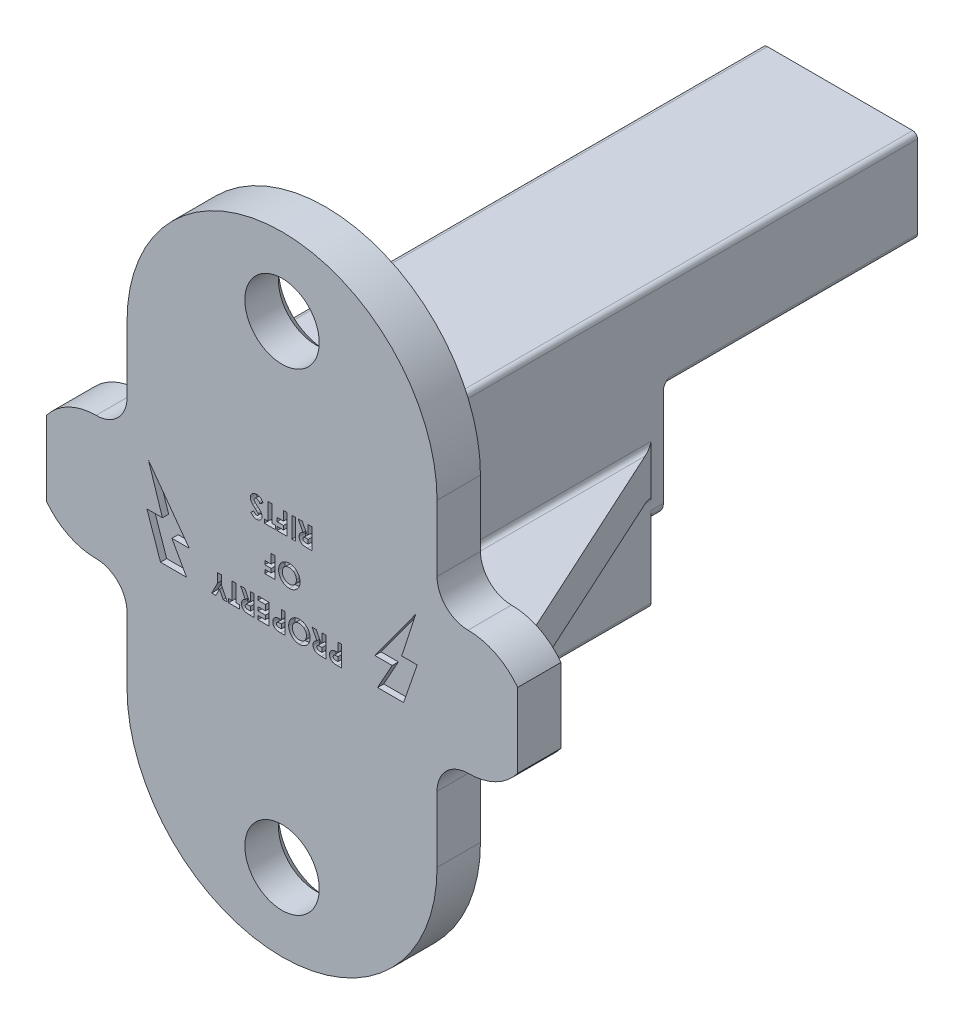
SolidWorks part; units mm, degrees
ref_plane "Front Plane" through (0, 0, 0) normal (0, 0, 1) x (1, 0, 0)
ref_plane "Top Plane" through (0, 0, 0) normal (0, 1, 0) x (1, 0, 0)
ref_plane "Right Plane" through (0, 0, 0) normal (1, 0, 0) x (0, 0, -1)
sketch "Sketch1" plane through (0, 0, 0) normal (0, 0, 1) x (1, 0, 0)
  line L1 (-683.5225, -1291.2464) -> (-651.7725, -1291.2464)
  line L2 (-683.5225, -1291.2464) -> (-683.5225, -1234.1695)
  line L3 (-683.5225, -1291.2464) -> (-651.7725, -1291.2464)
  line L4 (-683.5225, -1234.1695) -> (-651.7725, -1234.1695)
  line L5 (-651.7725, -1291.2464) -> (-651.7725, -1234.1695)
  line L6 (-658.1225, -1276.0275) -> (-677.1725, -1276.0275)
  line L7 (-683.5225, -1282.3775) -> (-683.5225, -1291.2464)
  line L8 (-651.7725, -1291.2464) -> (-651.7725, -1282.3775)
  circle A2 centre (-667.6475, -1337.5375) radius 25
  circle A4 centre (-705.1475, -1337.5375) radius 2.75
  circle A6 centre (-686.3975, -1370.0135) radius 2.75
  circle A8 centre (-648.8975, -1370.0135) radius 2.75
  circle A10 centre (-648.8975, -1305.0616) radius 2.75
  circle A12 centre (-630.1475, -1337.5375) radius 2.75
  circle A14 centre (-686.3975, -1305.0616) radius 2.75
  circle A16 centre (-659.9185, -1285.0159) radius 2.9
  circle A18 centre (-675.3764, -1285.0159) radius 2.9
  arc A28 (-677.1725, -1276.0275) -> (-683.5225, -1282.3775) centre (-677.1725, -1282.3775) ccw
  arc A29 (-687.1241, -1296.9708) -> (-683.5225, -1291.2464) centre (-689.8725, -1291.2464) ccw
  arc A30 (-687.1241, -1296.9708) -> (-648.1709, -1296.9708) centre (-667.6475, -1337.5375) ccw
  arc A31 (-651.7725, -1291.2464) -> (-648.1709, -1296.9708) centre (-645.4225, -1291.2464) ccw
  arc A32 (-651.7725, -1282.3775) -> (-658.1225, -1276.0275) centre (-658.1225, -1282.3775) ccw
extrude "Boss-Extrude1" add sketch "Sketch1" along normal blind 12.7 contours A32 L5 L4 L2 A28 L6 | L5 A32 L6 A28 L2 L1 A18 A16
sketch "Sketch2" plane through (0, 0, 12.7) normal (0, 0, 1) x (1, 0, 0)
  line L0 (-651.7725, -1272.2695) -> (-683.5225, -1272.2695)
  line L4 (-683.5225, -1234.1695) -> (-683.5225, -1291.2464)
  line L5 (-683.5225, -1291.2464) -> (-651.7725, -1291.2464)
  line L6 (-651.7725, -1291.2464) -> (-651.7725, -1234.1695)
  line L7 (-651.7725, -1234.1695) -> (-683.5225, -1234.1695)
  line L8 (-683.5225, -1234.1695) -> (-683.5225, -1291.2464)
  line L9 (-683.5225, -1291.2464) -> (-651.7725, -1291.2464)
  line L10 (-651.7725, -1291.2464) -> (-651.7725, -1234.1695)
  line L11 (-651.7725, -1234.1695) -> (-683.5225, -1234.1695)
  circle A0 centre (-675.3764, -1285.0159) radius 2.9 construction
  circle A1 centre (-659.9185, -1285.0159) radius 2.9 construction
  circle A2 centre (-675.3764, -1285.0159) radius 2.9
  circle A3 centre (-659.9185, -1285.0159) radius 2.9
  dimension "D2" = 38.1
  dimension "D1" = 0
extrude "Boss-Extrude2" add sketch "Sketch2" along normal blind 101.6 contours L0 M8 M9 M6
ref_plane "Plane1" through (-667.6475, 0, 0) normal (1, 0, 0) x (0, 0, -1)
sketch "Sketch7" plane through (0, -1272.2695, 0) normal (0, -1, 0) x (1, 0, 0)
  line L1 (-642.6475, 54.61) -> (-692.6475, 54.61)
  line L4 (-683.5225, 12.7) -> (-651.7725, 12.7)
  line L5 (-651.7725, 12.7) -> (-651.7725, 114.3)
  line L6 (-651.7725, 114.3) -> (-683.5225, 114.3)
  line L7 (-683.5225, 114.3) -> (-683.5225, 12.7)
  line L8 (-683.5225, 12.7) -> (-651.7725, 12.7)
  line L9 (-651.7725, 12.7) -> (-651.7725, 114.3)
  line L10 (-651.7725, 114.3) -> (-683.5225, 114.3)
  line L11 (-683.5225, 114.3) -> (-683.5225, 12.7)
  dimension "D1" = 0
extrude "Boss-Extrude4" add sketch "Sketch7" along normal blind 57.15 contours L1 M6 M7 M8
sketch "Sketch8" plane through (0, 0, 114.3) normal (0, 0, 1) x (1, 0, 0)
  line L4 (-683.5225, -1234.1695) -> (-683.5225, -1329.4195)
  line L5 (-683.5225, -1329.4195) -> (-651.7725, -1329.4195)
  line L6 (-651.7725, -1329.4195) -> (-651.7725, -1234.1695)
  line L7 (-651.7725, -1234.1695) -> (-683.5225, -1234.1695)
  line L8 (-683.5225, -1234.1695) -> (-683.5225, -1329.4195)
  line L9 (-683.5225, -1329.4195) -> (-651.7725, -1329.4195)
  line L10 (-651.7725, -1329.4195) -> (-651.7725, -1234.1695)
  line L11 (-651.7725, -1234.1695) -> (-683.5225, -1234.1695)
  circle A1 centre (-667.6475, -1337.5375) radius 12.3
  circle A2 centre (-667.6475, -1337.5375) radius 25 construction
  dimension "D1" = 0
  dimension "D2" = 12.7
extrude "Cut-Extrude4" cut sketch "Sketch8" against normal through all contours L9 A1
ref_plane "Plane3" through (-667.6475, 0, 0) normal (1, 0, 0) x (0, 0, -1)
sketch "Sketch11" plane through (-667.6475, 0, 0) normal (1, 0, 0) x (0, 0, -1)
  line L0 (-54.61, -1272.2695) -> (-12.7, -1272.2695) construction
  line L1 (-114.3, -1329.4195) -> (-114.3, -1234.1695) construction
  line L2 (0, -1291.2464) -> (0, -1234.1695) construction
  line L3 (-54.61, -1272.2695) -> (-12.7, -1272.2695) construction
  line L4 (-114.3, -1329.4195) -> (-114.3, -1234.1695) construction
  line L5 (0, -1291.2464) -> (0, -1234.1695) construction
  line L6 (-54.61, -1272.2695) -> (-114.3, -1272.2695) construction
  line L7 (0, -1243.1425) -> (-114.3, -1263.2966)
  line L8 (-114.3, -1234.1695) -> (0, -1234.1695) construction
  line L9 (0, -1234.1695) -> (0, -1243.1425) construction
  line L10 (-114.3, -1263.2966) -> (-114.3, -1272.2695) construction
  point P6 (0, -1243.1425)
  dimension "D1" = 10
ref_plane "Plane4" through (-667.6475, -1243.1425, 0) normal (0, -0.1736, 0.9848) x (1, 0, 0)
sketch "Sketch13" plane through (-667.6475, -1243.1425, 0) normal (0, -0.1736, 0.9848) x (1, 0, 0)
  line L8 (28.575, 21.5366) -> (-28.575, 21.5366)
  line L9 (28.575, -60.0731) -> (28.575, 21.5366)
  line L10 (-28.575, -60.0731) -> (28.575, -60.0731)
  line L11 (-28.575, 21.5366) -> (-28.575, -60.0731)
  line L12 (28.575, 21.5366) -> (-28.575, 21.5366)
  line L13 (28.575, -60.0731) -> (28.575, 21.5366)
  line L14 (-28.575, -60.0731) -> (28.575, -60.0731)
  line L15 (-28.575, 21.5366) -> (-28.575, -60.0731)
  dimension "D1" = 12.7
sketch "Sketch16" plane through (0, 0, 54.61) normal (0, 0, -1) x (-1, 0, 0)
  line L5 (676.8881, -1329.4195) -> (683.5225, -1329.4195)
  line L6 (683.5225, -1329.4195) -> (683.5225, -1272.2695)
  line L7 (683.5225, -1272.2695) -> (651.7725, -1272.2695)
  line L8 (651.7725, -1272.2695) -> (651.7725, -1329.4195)
  line L9 (651.7725, -1329.4195) -> (658.4069, -1329.4195)
  line L10 (676.8881, -1329.4195) -> (683.5225, -1329.4195)
  line L11 (683.5225, -1329.4195) -> (683.5225, -1272.2695)
  line L12 (683.5225, -1272.2695) -> (651.7725, -1272.2695)
  line L13 (651.7725, -1272.2695) -> (651.7725, -1329.4195)
  line L14 (651.7725, -1329.4195) -> (658.4069, -1329.4195)
  arc A1 (676.8881, -1329.4195) -> (658.4069, -1329.4195) centre (667.6475, -1337.5375) ccw
  arc A2 (676.8881, -1329.4195) -> (658.4069, -1329.4195) centre (667.6475, -1337.5375) ccw
  circle A3 centre (667.6475, -1337.5375) radius 25 construction
  circle A4 centre (667.6475, -1337.5375) radius 26.27
  dimension "D1" = 0
  dimension "D2" = 1.27
extrude "Boss-Extrude6" add sketch "Sketch16" along normal blind 2.54 contours A4 L11 M10 M11
fillet "Fillet8" radius 2.54 2 edges at (-683.5225, -1316.6067, 53.34) (-651.7725, -1316.6067, 53.34)
sketch "Sketch19" plane through (0, 0, 114.3) normal (0, 0, 1) x (1, 0, 0)
  line L0 (-669.4127, -1270.1271) -> (-661.9715, -1270.1271)
  line L1 (-661.9715, -1270.1271) -> (-666.1374, -1277.5684)
  line L2 (-666.1374, -1277.5684) -> (-661.167, -1277.5684)
  line L3 (-661.167, -1277.5684) -> (-672.9466, -1293.8012)
  line L4 (-672.9466, -1293.8012) -> (-668.8668, -1281.4183)
  line L5 (-668.8668, -1281.4183) -> (-673.5499, -1281.4183)
  line L6 (-673.5499, -1281.4183) -> (-669.4127, -1270.1271)
  line L7 (-668.8668, -1281.4183) -> (-666.1374, -1277.5684) construction
sketch "Sketch20" plane through (0, 0, 12.7) normal (0, 0, 1) x (1, 0, 0)
  line L4 (-683.5225, -1272.2695) -> (-683.5225, -1291.2464)
  line L5 (-683.5225, -1291.2464) -> (-651.7725, -1291.2464)
  line L6 (-651.7725, -1291.2464) -> (-651.7725, -1272.2695)
  line L7 (-651.7725, -1272.2695) -> (-683.5225, -1272.2695)
  line L8 (-683.5225, -1272.2695) -> (-683.5225, -1291.2464)
  line L9 (-683.5225, -1291.2464) -> (-651.7725, -1291.2464)
  line L10 (-651.7725, -1291.2464) -> (-651.7725, -1272.2695)
  line L11 (-651.7725, -1272.2695) -> (-683.5225, -1272.2695)
  circle A0 centre (-659.9185, -1285.0159) radius 2.9 construction
  circle A1 centre (-675.3764, -1285.0159) radius 2.9 construction
  circle A6 centre (-659.9185, -1285.0159) radius 2.9
  circle A7 centre (-675.3764, -1285.0159) radius 2.9
  dimension "D1" = 0
extrude "Boss-Extrude7" add sketch "Sketch20" along normal up to surface (39.37 mm away)
sketch "Sketch21" plane through (0, 0, 0) normal (0, 0, -1) x (-1, 0, 0)
  line L0 (651.7725, -1253.2195) -> (683.5225, -1253.2195)
  line L4 (651.7725, -1291.2464) -> (683.5225, -1291.2464)
  line L5 (683.5225, -1291.2464) -> (683.5225, -1234.1695)
  line L6 (683.5225, -1234.1695) -> (651.7725, -1234.1695)
  line L7 (651.7725, -1234.1695) -> (651.7725, -1291.2464)
  line L8 (651.7725, -1291.2464) -> (683.5225, -1291.2464)
  line L9 (683.5225, -1291.2464) -> (683.5225, -1234.1695)
  line L10 (683.5225, -1234.1695) -> (651.7725, -1234.1695)
  line L11 (651.7725, -1234.1695) -> (651.7725, -1291.2464)
  dimension "D2" = 19.05
  dimension "D1" = 0
extrude "Cut-Extrude5" cut sketch "Sketch21" against normal through all contours L0 M12 M10 M11
sketch "Sketch22" plane through (-667.6475, 0, 0) normal (1, 0, 0) x (0, 0, -1)
  line L0 (-1.6908, -1262.8083) -> (-114.3, -1282.6643)
  line L10 (0, -1253.2195) -> (-114.3, -1253.2195)
  line L11 (-114.3, -1253.2195) -> (-114.3, -1329.4195)
  line L12 (-114.3, -1329.4195) -> (-54.61, -1329.4195)
  line L13 (-54.61, -1329.4195) -> (-54.61, -1311.9994)
  line L14 (-54.61, -1311.9994) -> (-52.07, -1311.9994)
  line L15 (-54.61, -1311.9994) -> (-52.07, -1311.9994)
  line L16 (-52.07, -1311.9994) -> (-52.07, -1291.2464)
  line L17 (0, -1291.2464) -> (0, -1253.2195)
  line L19 (0, -1253.2195) -> (-114.3, -1253.2195) construction
  line L20 (-114.3, -1253.2195) -> (-114.3, -1329.4195) construction
  line L21 (-114.3, -1329.4195) -> (-54.61, -1329.4195) construction
  line L22 (-54.61, -1329.4195) -> (-54.61, -1311.9994) construction
  line L26 (0, -1291.2464) -> (0, -1253.2195) construction
  line L28 (-52.07, -1311.9994) -> (-52.07, -1291.2464)
  line L29 (-52.07, -1291.2464) -> (0, -1291.2464)
  line L30 (-52.07, -1291.2464) -> (0, -1291.2464)
  point P2 (-1.6908, -1262.8083)
  point P8 (-1.6908, -1262.8083)
  dimension "D3" = 10
  dimension "D1" = 0
sketch "Sketch23" plane through (-667.6475, -1243.1425, 0) normal (0, -0.1736, 0.9848) x (1, 0, 0)
  circle A0 centre (0, -19.0735) radius 4.7625 construction
  circle A1 centre (0, -19.0735) radius 5.1625
  point P0 (0, -19.0735)
  dimension "D1" = 9.525
  dimension "D2" = 0.4
sketch "Sketch24" plane through (0, 0, 54.61) normal (0, 0, -1) x (-1, 0, 0)
  line L4 (683.5225, -1329.4195) -> (683.5225, -1311.9994)
  line L5 (651.7725, -1311.9994) -> (651.7725, -1329.4195)
  line L6 (651.7725, -1329.4195) -> (658.4069, -1329.4195)
  line L7 (676.8881, -1329.4195) -> (683.5225, -1329.4195)
  line L8 (683.5225, -1329.4195) -> (683.5225, -1311.9994)
  line L9 (651.7725, -1311.9994) -> (651.7725, -1329.4195)
  line L10 (651.7725, -1329.4195) -> (658.4069, -1329.4195)
  line L11 (676.8881, -1329.4195) -> (683.5225, -1329.4195)
  arc A4 (679.8068, -1314.251) -> (683.5225, -1311.9994) centre (680.9825, -1311.9994) ccw
  arc A5 (679.8068, -1314.251) -> (655.4882, -1314.251) centre (667.6475, -1337.5375) ccw
  arc A6 (651.7725, -1311.9994) -> (655.4882, -1314.251) centre (654.3125, -1311.9994) ccw
  arc A7 (676.8881, -1329.4195) -> (658.4069, -1329.4195) centre (667.6475, -1337.5375) ccw
  arc A8 (679.8068, -1314.251) -> (683.5225, -1311.9994) centre (680.9825, -1311.9994) ccw
  arc A9 (679.8068, -1314.251) -> (655.4882, -1314.251) centre (667.6475, -1337.5375) ccw
  arc A10 (651.7725, -1311.9994) -> (655.4882, -1314.251) centre (654.3125, -1311.9994) ccw
  arc A11 (676.8881, -1329.4195) -> (658.4069, -1329.4195) centre (667.6475, -1337.5375) ccw
  dimension "D1" = 0
sketch "Sketch25" plane through (0, 0, 52.07) normal (0, 0, -1) x (-1, 0, 0)
  line L3 (683.5225, -1311.9994) -> (683.5225, -1291.2464)
  line L4 (683.5225, -1291.2464) -> (651.7725, -1291.2464)
  line L5 (651.7725, -1291.2464) -> (651.7725, -1311.9994)
  line L6 (683.5225, -1311.9994) -> (683.5225, -1291.2464)
  line L7 (683.5225, -1291.2464) -> (651.7725, -1291.2464)
  line L8 (651.7725, -1291.2464) -> (651.7725, -1311.9994)
  arc A7 (651.7725, -1311.9994) -> (655.4882, -1314.251) centre (654.3125, -1311.9994) ccw
  arc A8 (679.8068, -1314.251) -> (655.4882, -1314.251) centre (667.6475, -1337.5375) ccw
  arc A9 (679.8068, -1314.251) -> (683.5225, -1311.9994) centre (680.9825, -1311.9994) ccw
  arc A12 (651.7725, -1311.9994) -> (655.4882, -1314.251) centre (654.3125, -1311.9994) ccw
  arc A13 (679.8068, -1314.251) -> (655.4882, -1314.251) centre (667.6475, -1337.5375) ccw
  arc A14 (679.8068, -1314.251) -> (683.5225, -1311.9994) centre (680.9825, -1311.9994) ccw
  dimension "D1" = 0
sketch "Sketch30" plane through (0, 0, 0) normal (0, 0, -1) x (-1, 0, 0)
  circle A0 centre (659.9185, -1285.0159) radius 3.302
  circle A1 centre (675.3764, -1285.0159) radius 2.9
  circle A2 centre (675.3764, -1285.0159) radius 2.9
  circle A3 centre (659.9185, -1285.0159) radius 2.9
  circle A4 centre (659.9185, -1285.0159) radius 2.9
  circle A5 centre (675.3764, -1285.0159) radius 3.302
  dimension "D3" = 6.604
  dimension "D1" = 0
  dimension "D2" = 0
sketch "Sketch31" plane through (0, 0, 0) normal (0, 0, -1) x (-1, 0, 0)
  line L0 (654.3125, -1272.397) -> (651.7725, -1272.397)
  line L1 (680.9825, -1272.397) -> (683.5225, -1272.397)
  line L4 (683.5225, -1291.2464) -> (683.5225, -1253.2195)
  line L5 (683.5225, -1253.2195) -> (651.7725, -1253.2195)
  line L6 (651.7725, -1253.2195) -> (651.7725, -1291.2464)
  line L7 (651.7725, -1291.2464) -> (683.5225, -1291.2464)
  line L8 (683.5225, -1291.2464) -> (683.5225, -1253.2195)
  line L9 (683.5225, -1253.2195) -> (651.7725, -1253.2195)
  line L10 (651.7725, -1253.2195) -> (651.7725, -1291.2464)
  line L11 (651.7725, -1291.2464) -> (683.5225, -1291.2464)
  line L14 (683.5225, -1291.2464) -> (683.5225, -1274.937)
  line L15 (680.9825, -1272.397) -> (654.3125, -1272.397)
  line L16 (651.7725, -1274.937) -> (651.7725, -1291.2464)
  arc A10 (683.5225, -1274.937) -> (680.9825, -1272.397) centre (680.9825, -1274.937) ccw
  arc A11 (654.3125, -1272.397) -> (651.7725, -1274.937) centre (654.3125, -1274.937) ccw
  arc A12 (648.1709, -1296.9708) -> (651.7725, -1291.2464) centre (645.4225, -1291.2464) ccw
  arc A13 (648.1709, -1296.9708) -> (687.1241, -1296.9708) centre (667.6475, -1337.5375) ccw
  arc A14 (683.5225, -1291.2464) -> (687.1241, -1296.9708) centre (689.8725, -1291.2464) ccw
  dimension "D1" = 0
extrude "Cut-Extrude11" cut sketch "Sketch31" against normal through all contours L15 L1 L0 M15 M16 M17
sketch "Sketch35" plane through (-667.6475, 0, 0) normal (1, 0, 0) x (0, 0, -1)
  line L0 (0, -1291.2464) -> (-52.07, -1305.1985)
  line L1 (-52.07, -1291.2464) -> (0, -1291.2464) construction
  line L2 (0, -1291.2464) -> (0, -1272.397) construction
  line L3 (-52.07, -1291.2464) -> (-52.07, -1311.9994) construction
  dimension "D1" = 15
rib "Rib1" sketch "Sketch35" sketch "Sketch35" thickness 8.4667 extrusion direction parallel to sketch draft on no parameters "D1"=8.4667
sketch "Sketch38" plane through (0, 0, 52.07) normal (0, 0, -1) x (-1, 0, 0)
  circle A0 centre (675.3764, -1285.0159) radius 2.9 construction
  circle A1 centre (659.9185, -1285.0159) radius 2.9 construction
  circle A2 centre (675.3764, -1285.0159) radius 2.9
  circle A3 centre (659.9185, -1285.0159) radius 2.9
extrude "Boss-Extrude9" add sketch "Sketch38" along normal up to surface (52.07 mm away)
sketch "Sketch39" plane through (0, 0, 0) normal (0, 0, -1) x (-1, 0, 0)
  circle A2 centre (659.71, -1281.8217) radius 3.302
  circle A3 centre (675.585, -1281.8217) radius 3.302
  dimension "D1" = 6.604
extrude "Cut-Extrude13" cut sketch "Sketch39" against normal blind 38.89
sketch "Sketch41" plane through (0, 0, 114.3) normal (0, 0, 1) x (1, 0, 0)
  line L0 (-667.6475, -1301.6974) -> (-667.6475, -1325.2375) construction
  line L1 (-667.6475, -1301.6974) -> (-670.9837, -1301.6974) construction
  line L2 (-654.9475, -1307.7073) -> (-680.3475, -1307.7073) construction
  line L3 (-651.7725, -1272.397) -> (-683.5225, -1272.397)
  line L4 (-683.5225, -1329.4195) -> (-676.8881, -1329.4195)
  line L5 (-658.4069, -1329.4195) -> (-651.7725, -1329.4195)
  line L6 (-651.7725, -1272.397) -> (-683.5225, -1272.397) construction
  line L7 (-683.5225, -1329.4195) -> (-676.8881, -1329.4195) construction
  line L8 (-658.4069, -1329.4195) -> (-651.7725, -1329.4195) construction
  line L9 (-654.9475, -1298.8173) -> (-680.3475, -1298.8173) construction
  line L10 (-654.9475, -1289.9273) -> (-680.3475, -1289.9273) construction
  arc A3 (-651.7725, -1329.4195) -> (-651.7725, -1272.397) centre (-651.7725, -1300.9083) ccw
  arc A4 (-683.5225, -1272.397) -> (-683.5225, -1329.4195) centre (-683.5225, -1300.9083) ccw
  arc A5 (-658.4069, -1329.4195) -> (-676.8881, -1329.4195) centre (-667.6475, -1337.5375) ccw
  arc A6 (-651.7725, -1329.4195) -> (-651.7725, -1272.397) centre (-651.7725, -1300.9083) ccw construction
  arc A7 (-683.5225, -1272.397) -> (-683.5225, -1329.4195) centre (-683.5225, -1300.9083) ccw construction
  arc A8 (-658.4069, -1329.4195) -> (-676.8881, -1329.4195) centre (-667.6475, -1337.5375) ccw construction
  text T0 "<b>PROPERTY</b>" font "Century Gothic" height in points 16
  text T1 "<b>OF</b>" font "Century Gothic" height in points 16
  text T2 "<b>RIFTS</b>" font "Century Gothic" height in points 16
  point P0 (-667.6475, -1313.4674)
  point P14 (-667.6475, -1289.9273)
  point P18 (-667.6475, -1313.4674)
  point P19 (-667.6475, -1301.6974)
  point P23 (-667.6475, -1289.9273)
  dimension "D2" = 25.4
  dimension "D3" = 8.89
  dimension "D4" = 8.89
  dimension "D1" = 0
sketch "Sketch42" plane through (0, 0, 114.3) normal (0, 0, 1) x (1, 0, 0)
  line L0 (-667.6475, -1272.397) -> (-667.6475, -1337.5375) construction
  line L1 (-635.8975, -1272.397) -> (-635.8975, -1337.5375)
  line L2 (-699.3975, -1272.397) -> (-699.3975, -1337.5375)
  line L5 (-658.4069, -1329.4195) -> (-651.7725, -1329.4195)
  line L6 (-651.7725, -1329.4195) -> (-651.7725, -1272.397)
  line L7 (-651.7725, -1272.397) -> (-683.5225, -1272.397)
  line L8 (-683.5225, -1272.397) -> (-683.5225, -1329.4195)
  line L9 (-683.5225, -1329.4195) -> (-676.8881, -1329.4195)
  line L10 (-658.4069, -1329.4195) -> (-651.7725, -1329.4195)
  line L11 (-651.7725, -1329.4195) -> (-651.7725, -1272.397)
  line L12 (-651.7725, -1272.397) -> (-683.5225, -1272.397)
  line L13 (-683.5225, -1272.397) -> (-683.5225, -1329.4195)
  line L14 (-683.5225, -1329.4195) -> (-676.8881, -1329.4195)
  arc A0 (-635.8975, -1272.397) -> (-699.3975, -1272.397) centre (-667.6475, -1272.397) ccw
  arc A1 (-699.3975, -1337.5375) -> (-635.8975, -1337.5375) centre (-667.6475, -1337.5375) ccw
  arc A5 (-658.4069, -1329.4195) -> (-676.8881, -1329.4195) centre (-667.6475, -1337.5375) ccw
  arc A8 (-658.4069, -1329.4195) -> (-676.8881, -1329.4195) centre (-667.6475, -1337.5375) ccw
  point P9 (-667.6475, -1304.9673)
  dimension "D2" = 31.75
  dimension "D1" = 0
extrude "Boss-Extrude10" add sketch "Sketch42" against normal blind 8.89
sketch "Sketch43" plane through (0, 0, 105.41) normal (0, 0, -1) x (-1, 0, 0)
  line L0 (635.8975, -1272.397) -> (699.3975, -1272.397) construction
  line L1 (667.6475, -1272.397) -> (667.6475, -1240.647) construction
  line L2 (699.3975, -1337.5375) -> (699.3975, -1272.397)
  line L3 (635.8975, -1272.397) -> (635.8975, -1337.5375)
  line L4 (699.3975, -1337.5375) -> (699.3975, -1272.397)
  line L5 (635.8975, -1272.397) -> (635.8975, -1337.5375)
  line L6 (699.3975, -1337.5375) -> (635.8975, -1337.5375) construction
  line L7 (667.6475, -1337.5375) -> (667.6475, -1369.2875) construction
  circle A0 centre (667.6475, -1353.4125) radius 7.62
  circle A1 centre (667.6475, -1256.522) radius 7.62
  arc A2 (699.3975, -1272.397) -> (635.8975, -1272.397) centre (667.6475, -1272.397) ccw
  arc A3 (635.8975, -1337.5375) -> (699.3975, -1337.5375) centre (667.6475, -1337.5375) ccw
  arc A4 (699.3975, -1272.397) -> (635.8975, -1272.397) centre (667.6475, -1272.397) ccw
  arc A5 (635.8975, -1337.5375) -> (699.3975, -1337.5375) centre (667.6475, -1337.5375) ccw
  dimension "D2" = 15.24
  dimension "D1" = 0
extrude "Cut-Extrude14" cut sketch "Sketch43" against normal through all contours A1 | A0
chamfer "Chamfer1" distance 2 angle 45 2 edges at (-675.2675, -1353.4125, 105.41) (-675.2675, -1256.522, 105.41)
ref_plane "Plane5" through (0, -1300.9083, 0) normal (0, -1, 0) x (-1, 0, 0)
ref_plane "Plane6" through (-667.6475, 0, 0) normal (1, 0, 0) x (0, 0, -1)
fillet "Fillet12" radius 1 4 edges at (-683.5225, -1291.2464, 26.035) (-651.7725, -1291.2464, 26.035) (-683.5225, -1272.397, 52.705) (-651.7725, -1272.397, 52.705)
extrude "Cut-Extrude16" cut sketch "Sketch41" against normal blind 1.27
sketch "Sketch44" plane through (0, 0, 105.41) normal (0, 0, -1) x (-1, 0, 0)
  line L0 (635.8975, -1304.9673) -> (629.5475, -1304.9673) construction
  line L1 (635.8975, -1304.9673) -> (629.5475, -1304.9673) construction
  line L2 (699.3975, -1337.5375) -> (699.3975, -1272.397)
  line L3 (635.8975, -1272.397) -> (635.8975, -1337.5375)
  line L4 (699.3975, -1337.5375) -> (699.3975, -1272.397)
  line L5 (635.8975, -1272.397) -> (635.8975, -1337.5375)
  line L6 (635.8975, -1317.6673) -> (629.5475, -1317.6673)
  line L7 (635.8975, -1292.2673) -> (629.5475, -1292.2673)
  line L8 (667.6475, -1240.647) -> (667.6475, -1253.0756) construction
  line L9 (699.3975, -1304.9673) -> (705.7475, -1304.9673) construction
  line L10 (699.3975, -1304.9673) -> (705.7475, -1304.9673) construction
  line L11 (699.3975, -1317.6673) -> (705.7475, -1317.6673)
  line L12 (699.3975, -1292.2673) -> (705.7475, -1292.2673)
  arc A0 (635.8975, -1317.6673) -> (635.8975, -1292.2673) centre (635.8975, -1304.9673) ccw
  arc A1 (629.5475, -1292.2673) -> (629.5475, -1317.6673) centre (629.5475, -1304.9673) ccw
  arc A2 (699.3975, -1272.397) -> (635.8975, -1272.397) centre (667.6475, -1272.397) ccw
  arc A3 (635.8975, -1337.5375) -> (699.3975, -1337.5375) centre (667.6475, -1337.5375) ccw
  arc A4 (699.3975, -1272.397) -> (635.8975, -1272.397) centre (667.6475, -1272.397) ccw
  arc A5 (635.8975, -1337.5375) -> (699.3975, -1337.5375) centre (667.6475, -1337.5375) ccw
  arc A6 (699.3975, -1317.6673) -> (699.3975, -1292.2673) centre (699.3975, -1304.9673) cw
  arc A7 (705.7475, -1292.2673) -> (705.7475, -1317.6673) centre (705.7475, -1304.9673) cw
  point P8 (632.7225, -1304.9673)
  point P17 (702.5725, -1304.9673)
  dimension "D2" = 12.7
  dimension "D3" = 6.35
  dimension "D1" = 0
extrude "Boss-Extrude11" add sketch "Sketch44" against normal up to surface (8.89 mm away) contours L7 A1 L6 L5 | A7 L12 L4 L11
fillet "Fillet14" radius 6.35 4 edges at (-699.3975, -1292.2673, 109.855) (-699.3975, -1317.6673, 109.855) (-635.8975, -1292.2673, 109.855) (-635.8975, -1317.6673, 109.855)
ref_plane "Plane7" through (0, -1304.9673, 0) normal (0, -1, 0) x (-1, 0, 0)
sketch "Sketch45" plane through (0, -1304.9673, 0) normal (0, -1, 0) x (-1, 0, 0)
  line L0 (651.7725, -54.61) -> (628.4892, -105.41)
rib "Rib4" sketch "Sketch45" sketch "Sketch45" thickness 8.4667 extrusion direction parallel to sketch draft on no parameters "D1"=8.4667
mirror "Mirror1" about plane through (-667.6475, 0, 0) normal (1, 0, 0) of "Rib4"
fillet "Fillet15" radius 1 6 edges at (-683.5225, -1309.2006, 80.01) (-706.8058, -1304.9673, 105.41) (-683.5225, -1300.7339, 80.01) (-628.4892, -1304.9673, 105.41) (-651.7725, -1300.7339, 80.01) (-651.7725, -1309.2006, 80.01)
fillet "Fillet17" radius 1 3 edges at (-667.6475, -1305.1985, 52.07) (-671.8808, -1291.2464, 26.035) (-663.4142, -1291.2464, 26.035)
fillet "Fillet18" radius 1 8 edges at (-671.8808, -1299.1061, 52.07) (-672.1737, -1291.5392, 52.07) (-683.2296, -1290.9535, 52.07) (-652.0654, -1290.9535, 52.07) (-663.4142, -1299.1061, 52.07) (-663.1213, -1291.5392, 52.07) (-677.7017, -1291.2464, 52.07) (-657.5933, -1291.2464, 52.07)
sketch "Sketch46" plane through (0, 0, 114.3) normal (0, 0, 1) x (1, 0, 0)
  line L14 (-695.0062, -1294.837) -> (-692.1539, -1303.6349)
  line L15 (-692.1539, -1303.6349) -> (-695.3347, -1303.6349)
  line L16 (-695.3347, -1303.6349) -> (-692.5427, -1311.7125)
  line L17 (-692.5427, -1311.7125) -> (-687.2139, -1311.7125)
  line L18 (-687.2139, -1311.7125) -> (-690.2099, -1306.2996)
  line L19 (-690.2099, -1306.2996) -> (-686.6539, -1306.2996)
  line L20 (-686.6539, -1306.2996) -> (-695.0062, -1294.837)
  line L21 (-642.7523, -1311.7125) -> (-639.9603, -1303.6349)
  line L22 (-639.9603, -1303.6349) -> (-643.1411, -1303.6349)
  line L23 (-643.1411, -1303.6349) -> (-640.2887, -1294.837)
  line L24 (-640.2887, -1294.837) -> (-648.6411, -1306.2996)
  line L25 (-648.6411, -1306.2996) -> (-645.085, -1306.2996)
  line L26 (-645.085, -1306.2996) -> (-648.0811, -1311.7125)
  line L27 (-648.0811, -1311.7125) -> (-642.7523, -1311.7125)
extrude "Cut-Extrude17" cut sketch "Sketch46" against normal blind 1.27
sketch "Sketch47" plane through (0, 0, 54.61) normal (0, 0, -1) x (-1, 0, 0)
  line L4 (651.7725, -1311.9994) -> (651.7725, -1329.4195)
  line L5 (651.7725, -1329.4195) -> (658.4069, -1329.4195)
  line L6 (676.8881, -1329.4195) -> (683.5225, -1329.4195)
  line L7 (683.5225, -1329.4195) -> (683.5225, -1311.9994)
  line L8 (651.7725, -1311.9994) -> (651.7725, -1329.4195)
  line L9 (651.7725, -1329.4195) -> (658.4069, -1329.4195)
  line L10 (676.8881, -1329.4195) -> (683.5225, -1329.4195)
  line L11 (683.5225, -1329.4195) -> (683.5225, -1311.9994)
  circle A0 centre (667.6475, -1337.5375) radius 12.5
  circle A1 centre (667.6475, -1337.5375) radius 15.04
  arc A7 (676.8881, -1329.4195) -> (658.4069, -1329.4195) centre (667.6475, -1337.5375) ccw
  arc A9 (679.8068, -1314.251) -> (683.5225, -1311.9994) centre (680.9825, -1311.9994) ccw
  arc A10 (679.8068, -1314.251) -> (655.4882, -1314.251) centre (667.6475, -1337.5375) ccw
  arc A11 (651.7725, -1311.9994) -> (655.4882, -1314.251) centre (654.3125, -1311.9994) ccw
  arc A13 (676.8881, -1329.4195) -> (658.4069, -1329.4195) centre (667.6475, -1337.5375) ccw
  arc A15 (679.8068, -1314.251) -> (683.5225, -1311.9994) centre (680.9825, -1311.9994) ccw
  arc A16 (679.8068, -1314.251) -> (655.4882, -1314.251) centre (667.6475, -1337.5375) ccw
  arc A17 (651.7725, -1311.9994) -> (655.4882, -1314.251) centre (654.3125, -1311.9994) ccw
  dimension "D2" = 25
  dimension "D1" = 0
  dimension "D3" = 2.54
extrude "Cut-Extrude19" cut sketch "Sketch47" against normal up to surface (50.8 mm away) contours L10 A1 L9 A0 | A0 L9 M16 M15
fillet "Fillet19" radius 1 4 edges at (-680.3085, -1329.4195, 80.01) (-683.5225, -1329.4195, 80.01) (-654.9865, -1329.4195, 80.01) (-651.7725, -1329.4195, 80.01)
fillet "Fillet20" radius 1 22 edges at (-639.31, -1300.7339, 105.41) (-651.4796, -1300.441, 105.41) (-695.985, -1300.7339, 105.41) (-683.8154, -1300.441, 105.41) (-683.5225, -1286.5655, 105.41) (-683.2296, -1272.6899, 105.41) (-667.6475, -1272.397, 105.41) (-652.0654, -1272.6899, 105.41) (-695.985, -1309.2006, 105.41) (-683.8154, -1309.4935, 105.41) (-683.5225, -1319.3101, 105.41) (-683.2296, -1329.1267, 105.41) (-681.6832, -1329.4195, 105.41) (-680.3793, -1329.3051, 105.41) (-667.6475, -1322.4975, 105.41) (-654.9156, -1329.3051, 105.41) (-653.6118, -1329.4195, 105.41) (-652.0654, -1329.1267, 105.41) (-639.31, -1309.2006, 105.41) (-651.4796, -1309.4935, 105.41) (-651.7725, -1286.5655, 105.41) (-651.7725, -1319.3101, 105.41)
sketch "Sketch48" plane through (0, 0, 105.41) normal (0, 0, -1) x (-1, 0, 0)
  line L0 (667.6475, -1240.647) -> (667.6475, -1369.2875) construction
  line L1 (718.4475, -1304.9673) -> (616.8475, -1304.9673) construction
  line L2 (680.0909, -1366.7475) -> (655.2041, -1366.7475)
  line L3 (619.3875, -1297.3473) -> (619.3875, -1312.5873)
  line L4 (635.8975, -1324.0173) -> (635.8975, -1337.5375)
  line L5 (699.3975, -1337.5375) -> (699.3975, -1324.0173)
  line L6 (699.3975, -1285.9173) -> (699.3975, -1272.397)
  line L7 (635.8975, -1272.397) -> (635.8975, -1285.9173)
  line L8 (635.8975, -1324.0173) -> (635.8975, -1337.5375)
  line L9 (699.3975, -1337.5375) -> (699.3975, -1324.0173)
  line L10 (699.3975, -1285.9173) -> (699.3975, -1272.397)
  line L11 (635.8975, -1272.397) -> (635.8975, -1285.9173)
  line L12 (715.9075, -1297.3473) -> (715.9075, -1312.5873)
  line L13 (680.0909, -1243.187) -> (655.2041, -1243.187)
  arc A8 (629.5475, -1292.2673) -> (629.5475, -1317.6673) centre (629.5475, -1304.9673) ccw
  arc A9 (635.8975, -1324.0173) -> (629.5475, -1317.6673) centre (629.5475, -1324.0173) ccw
  arc A10 (635.8975, -1337.5375) -> (699.3975, -1337.5375) centre (667.6475, -1337.5375) ccw
  arc A11 (705.7475, -1317.6673) -> (699.3975, -1324.0173) centre (705.7475, -1324.0173) ccw
  arc A12 (705.7475, -1317.6673) -> (705.7475, -1292.2673) centre (705.7475, -1304.9673) ccw
  arc A13 (699.3975, -1285.9173) -> (705.7475, -1292.2673) centre (705.7475, -1285.9173) ccw
  arc A14 (699.3975, -1272.397) -> (635.8975, -1272.397) centre (667.6475, -1272.397) ccw
  arc A15 (629.5475, -1292.2673) -> (635.8975, -1285.9173) centre (629.5475, -1285.9173) ccw
  arc A16 (629.5475, -1292.2673) -> (629.5475, -1317.6673) centre (629.5475, -1304.9673) ccw
  arc A17 (635.8975, -1324.0173) -> (629.5475, -1317.6673) centre (629.5475, -1324.0173) ccw
  arc A18 (635.8975, -1337.5375) -> (699.3975, -1337.5375) centre (667.6475, -1337.5375) ccw
  arc A19 (705.7475, -1317.6673) -> (699.3975, -1324.0173) centre (705.7475, -1324.0173) ccw
  arc A20 (705.7475, -1317.6673) -> (705.7475, -1292.2673) centre (705.7475, -1304.9673) ccw
  arc A21 (699.3975, -1285.9173) -> (705.7475, -1292.2673) centre (705.7475, -1285.9173) ccw
  arc A22 (699.3975, -1272.397) -> (635.8975, -1272.397) centre (667.6475, -1272.397) ccw
  arc A23 (629.5475, -1292.2673) -> (635.8975, -1285.9173) centre (629.5475, -1285.9173) ccw
  point P16 (619.3875, -1304.9673)
  point P19 (667.6475, -1366.7475)
  point P29 (667.6475, -1366.7475)
  point P32 (619.3875, -1304.9673)
  dimension "D2" = 2.54
  dimension "D3" = 2.54
  dimension "D1" = 0
extrude "Cut-Extrude20" cut sketch "Sketch48" against normal through all contours L3 M37 | L12 M43
